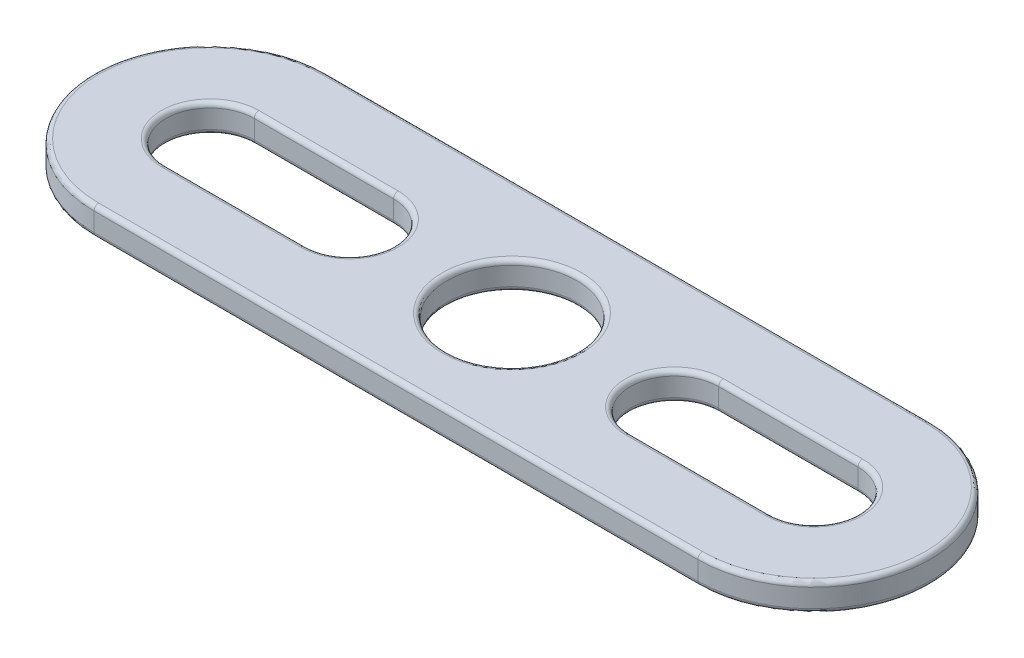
SolidWorks part; units mm, degrees
ref_plane "Front" through (0, 0, 0) normal (0, 0, 1) x (1, 0, 0)
ref_plane "Top" through (0, 0, 0) normal (0, 1, 0) x (1, 0, 0)
ref_plane "Right" through (0, 0, 0) normal (1, 0, 0) x (0, 0, -1)
sketch "Sketch1" plane through (0, 0, 0) normal (0, 1, 0) x (1, 0, 0)
  line L1 (0, 0) -> (33.02, 0)
  line L2 (0, 8.763) -> (7.62, 8.763)
  line L3 (0, 12.7) -> (33.02, 12.7)
  line L5 (0, 3.937) -> (7.62, 3.937)
  line L7 (25.4, 8.763) -> (33.02, 8.763)
  line L9 (25.4, 3.937) -> (33.02, 3.937)
  arc A0 (0, 12.7) -> (0, 0) centre (0, 6.35) ccw
  arc A1 (33.02, 0) -> (33.02, 12.7) centre (33.02, 6.35) ccw
  circle A2 centre (16.51, 6.35) radius 3.556
  arc A3 (0, 8.763) -> (0, 3.937) centre (0, 6.35) ccw
  arc A4 (7.62, 3.937) -> (7.62, 8.763) centre (7.62, 6.35) ccw
  arc A5 (25.4, 8.763) -> (25.4, 3.937) centre (25.4, 6.35) ccw
  arc A6 (33.02, 3.937) -> (33.02, 8.763) centre (33.02, 6.35) ccw
  dimension "D4" = 7.112
  dimension "D1" = 12.7
  dimension "D5" = 4.826
  dimension "D6" = 2.413
  dimension "D7" = 7.62
  dimension "D8" = 8.89
  dimension "D9" = 8.89
extrude "Extrude1" add sketch "Sketch1" along normal blind 1.524
fillet "Fillet1" radius 0.254 26 edges at (39.37, 1.524, -6.35) (16.51, 0, -2.794) (16.51, 1.524, -2.794) (16.51, 1.524, -12.7) (-2.413, 0, -6.35) (3.81, 0, -3.937) (10.033, 0, -6.35) (3.81, 0, -8.763) (-2.413, 1.524, -6.35) (3.81, 1.524, -3.937) (10.033, 1.524, -6.35) (3.81, 1.524, -8.763) (22.987, 0, -6.35) (29.21, 0, -3.937) (35.433, 0, -6.35) (29.21, 0, -8.763) (22.987, 1.524, -6.35) (29.21, 1.524, -3.937) (35.433, 1.524, -6.35) (29.21, 1.524, -8.763) (-6.35, 1.524, -6.35) (16.51, 0, -12.7) (39.37, 0, -6.35) (16.51, 0, 0) (-6.35, 0, -6.35) (16.51, 1.524, 0)
